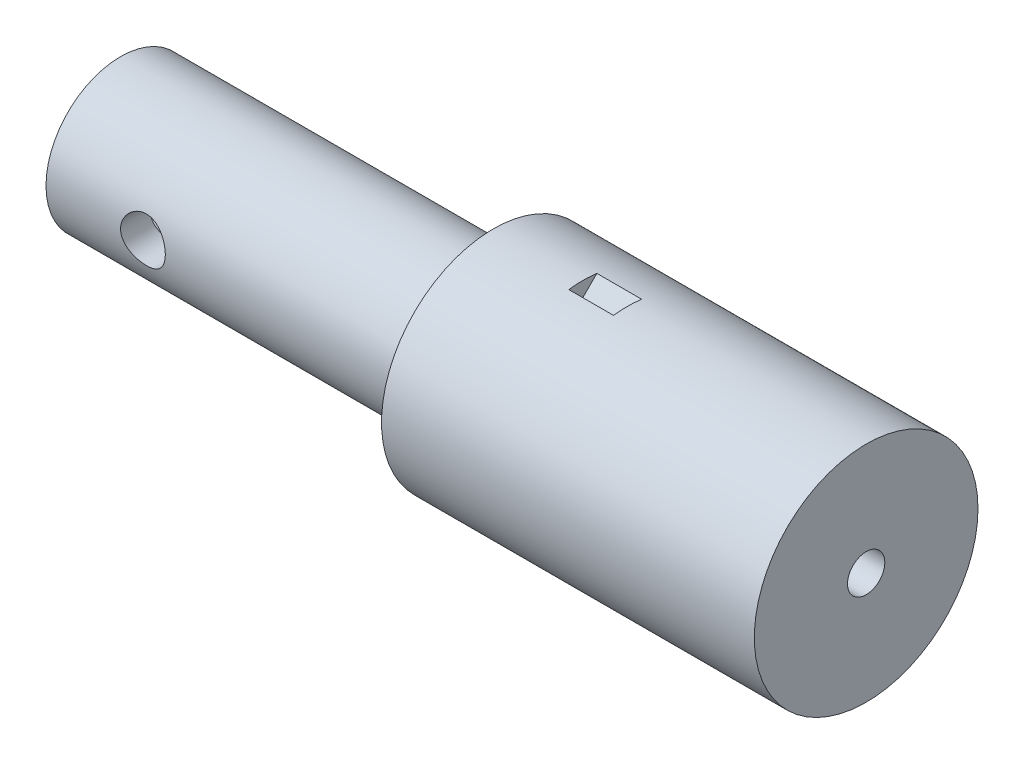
SolidWorks part; units mm, degrees
ref_plane "Front Plane" through (0, 0, 0) normal (0, 0, 1) x (1, 0, 0)
ref_plane "Top Plane" through (0, 0, 0) normal (0, 1, 0) x (1, 0, 0)
ref_plane "Right Plane" through (0, 0, 0) normal (1, 0, 0) x (0, 0, -1)
sketch "Sketch1" plane through (0, 0, 0) normal (1, 0, 0) x (0, 0, -1)
  circle A0 centre (0, 0) radius 15
  dimension "D1" = 30
extrude "Boss-Extrude1" add sketch "Sketch1" along normal blind 50
sketch "Sketch2" plane through (0, 0, 0) normal (-1, 0, 0) x (0, 0, 1)
  circle A0 centre (0, 0) radius 10
  dimension "D1" = 20
extrude "Boss-Extrude2" add sketch "Sketch2" along normal blind 50
sketch "Sketch3" plane through (-50, 0, 0) normal (-1, 0, 0) x (0, 0, 1)
  circle A0 centre (0, 0) radius 6
  dimension "D1" = 12
extrude "Cut-Extrude1" cut sketch "Sketch3" against normal blind 79.1
sketch "Sketch4" plane through (29.1, 0, 0) normal (-1, 0, 0) x (0, 0, 1)
  circle A0 centre (0, 0) radius 2.5
  dimension "D1" = 5
extrude "Cut-Extrude2" cut sketch "Sketch4" against normal blind 79.1
chamfer "Chamfer1" distance 5 angle 45 1 edges at (29.1, 0, 2.5)
sketch "Sketch5" plane through (0, 0, 0) normal (0, 0, 1) x (1, 0, 0)
  line L0 (-50, 10) -> (-50, -10) construction
  circle A0 centre (-37, 0) radius 3
  dimension "D2" = 6
  dimension "D1" = 13
extrude "Cut-Extrude3" cut sketch "Sketch5" against normal mid plane 79.1
ref_plane "Plane1" through (15, 0, 0) normal (1, 0, 0) x (0, 0, -1)
sketch "Sketch6" plane through (15, 0, 0) normal (1, 0, 0) x (0, 0, -1)
  line L1 (0, 13) -> (1.8815, 14.8815)
  line L2 (0, 13) -> (-1.8815, 14.8815)
  circle A0 centre (0, 0) radius 15 construction
  arc A1 (1.8815, 14.8815) -> (-1.8815, 14.8815) centre (0, 0) ccw
extrude "Cut-Extrude5" cut sketch "Sketch6" against normal mid plane 6
